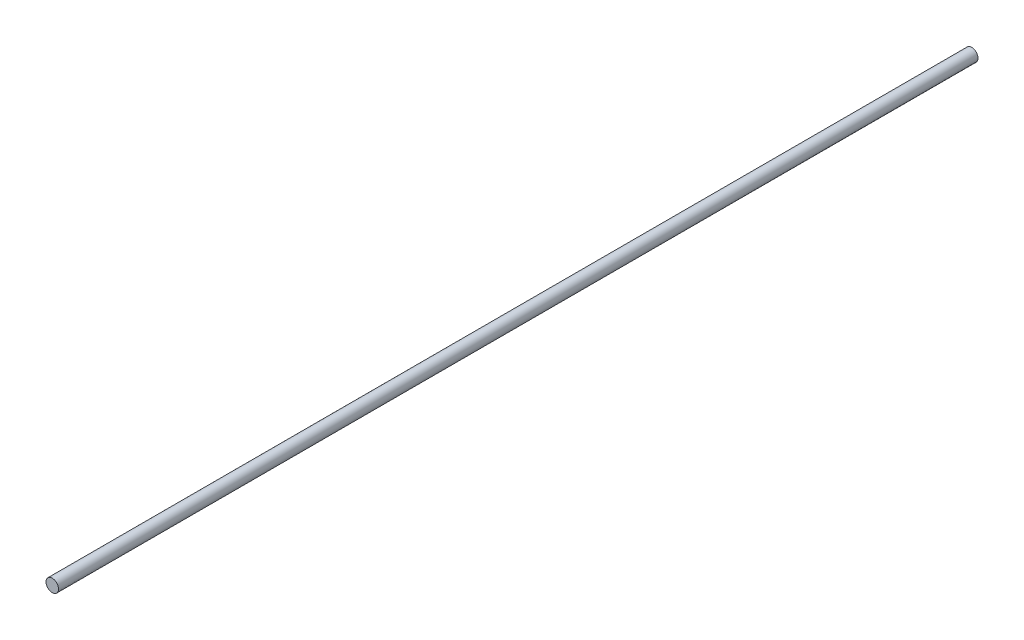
SolidWorks part; units mm, degrees
ref_plane "Front Plane" through (0, 0, 0) normal (0, 0, 1) x (1, 0, 0)
ref_plane "Top Plane" through (0, 0, 0) normal (0, 1, 0) x (1, 0, 0)
ref_plane "Right Plane" through (0, 0, 0) normal (1, 0, 0) x (0, 0, -1)
sketch "Sketch1" plane through (0, 0, 0) normal (0, 0, 1) x (1, 0, 0)
  circle A0 centre (0, 0) radius 30
  dimension "D1" = 60
extrude "Boss-Extrude1" add sketch "Sketch1" against normal blind 4400
